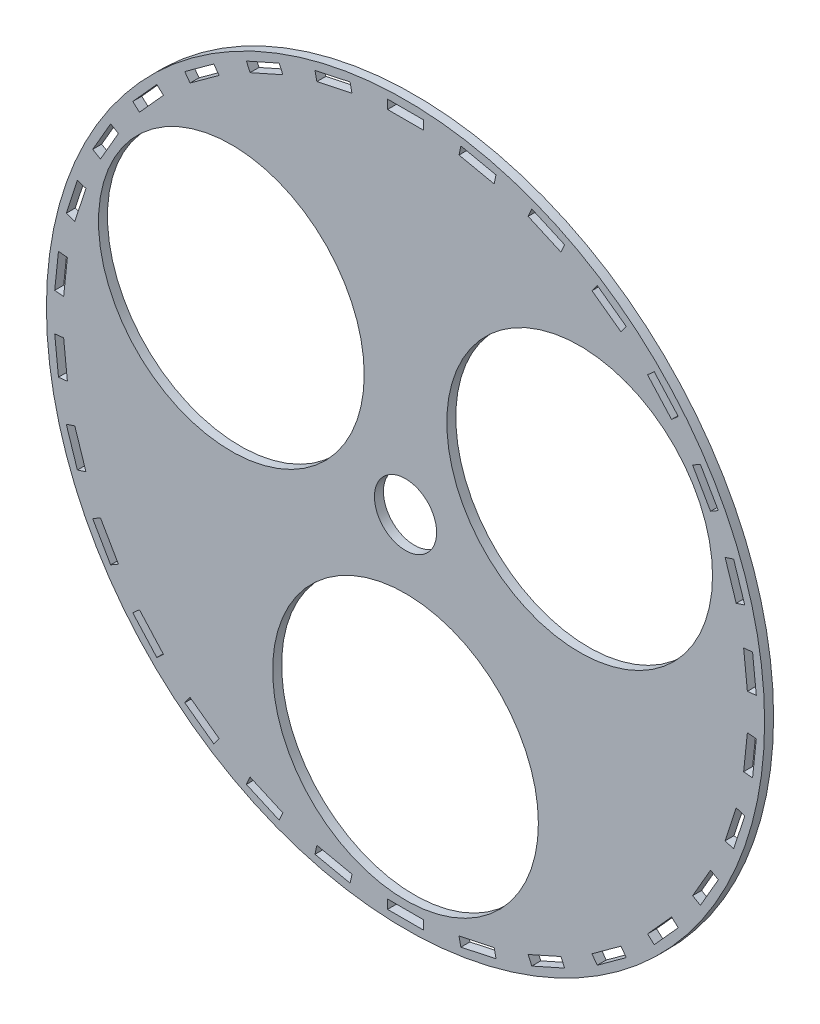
SolidWorks part; units mm, degrees
ref_plane "Front Plane" through (0, 0, 0) normal (0, 0, 1) x (1, 0, 0)
ref_plane "Top Plane" through (0, 0, 0) normal (0, 1, 0) x (1, 0, 0)
ref_plane "Right Plane" through (0, 0, 0) normal (1, 0, 0) x (0, 0, -1)
sketch "Sketch1" plane through (0, 0, 0) normal (0, 0, 1) x (1, 0, 0)
  line L0 (-31.3486, -116.9417) -> (-18.9261, -119.5822)
  line L1 (-6.35, -120.904) -> (6.35, -120.904)
  line L2 (-6.35, -120.904) -> (-6.35, -124.079)
  line L3 (-6.35, -124.079) -> (6.35, -124.079)
  line L4 (6.35, -120.904) -> (6.35, -124.079)
  line L5 (-31.3486, -116.9417) -> (-32.0087, -120.0473)
  line L6 (-32.0087, -120.0473) -> (-19.5862, -122.6878)
  line L7 (-18.9261, -119.5822) -> (-19.5862, -122.6878)
  line L8 (-54.9771, -107.8685) -> (-43.3751, -113.0341)
  line L9 (-54.9771, -107.8685) -> (-56.2685, -110.769)
  line L10 (-56.2685, -110.769) -> (-44.6665, -115.9346)
  line L11 (-43.3751, -113.0341) -> (-44.6665, -115.9346)
  line L12 (-76.2028, -94.081) -> (-65.9283, -101.5458)
  line L13 (-76.2028, -94.081) -> (-78.0691, -96.6496)
  line L14 (-78.0691, -96.6496) -> (-67.7945, -104.1145)
  line L15 (-65.9283, -101.5458) -> (-67.7945, -104.1145)
  line L16 (-94.0982, -76.1816) -> (-85.6002, -85.6195)
  line L17 (-94.0982, -76.1816) -> (-96.4576, -78.3061)
  line L18 (-96.4576, -78.3061) -> (-87.9597, -87.744)
  line L19 (-85.6002, -85.6195) -> (-87.9597, -87.744)
  line L20 (-107.8809, -54.9527) -> (-101.5309, -65.9513)
  line L21 (-107.8809, -54.9527) -> (-110.6306, -56.5402)
  line L22 (-110.6306, -56.5402) -> (-104.2806, -67.5388)
  line L23 (-101.5309, -65.9513) -> (-104.2806, -67.5388)
  line L24 (-116.9488, -31.3222) -> (-113.0243, -43.4006)
  line L25 (-116.9488, -31.3222) -> (-119.9684, -32.3033)
  line L26 (-119.9684, -32.3033) -> (-116.0439, -44.3817)
  line L27 (-113.0243, -43.4006) -> (-116.0439, -44.3817)
  line L28 (-120.9054, -6.3227) -> (-119.5779, -18.9531)
  line L29 (-120.9054, -6.3227) -> (-124.063, -6.6546)
  line L30 (-124.063, -6.6546) -> (-122.7355, -19.285)
  line L31 (-119.5779, -18.9531) -> (-122.7355, -19.285)
  line L32 (-119.5779, 18.9531) -> (-120.9054, 6.3227)
  line L33 (-119.5779, 18.9531) -> (-122.7355, 19.285)
  line L34 (-122.7355, 19.285) -> (-124.063, 6.6546)
  line L35 (-120.9054, 6.3227) -> (-124.063, 6.6546)
  line L36 (-113.0243, 43.4006) -> (-116.9488, 31.3222)
  line L37 (-113.0243, 43.4006) -> (-116.0439, 44.3817)
  line L38 (-116.0439, 44.3817) -> (-119.9684, 32.3033)
  line L39 (-116.9488, 31.3222) -> (-119.9684, 32.3033)
  line L40 (-101.5309, 65.9513) -> (-107.8809, 54.9527)
  line L41 (-101.5309, 65.9513) -> (-104.2806, 67.5388)
  line L42 (-104.2806, 67.5388) -> (-110.6306, 56.5402)
  line L43 (-107.8809, 54.9527) -> (-110.6306, 56.5402)
  line L44 (-85.6002, 85.6195) -> (-94.0982, 76.1816)
  line L45 (-85.6002, 85.6195) -> (-87.9597, 87.744)
  line L46 (-87.9597, 87.744) -> (-96.4576, 78.3061)
  line L47 (-94.0982, 76.1816) -> (-96.4576, 78.3061)
  line L48 (-65.9283, 101.5458) -> (-76.2028, 94.081)
  line L49 (-65.9283, 101.5458) -> (-67.7945, 104.1145)
  line L50 (-67.7945, 104.1145) -> (-78.0691, 96.6496)
  line L51 (-76.2028, 94.081) -> (-78.0691, 96.6496)
  line L52 (-43.3751, 113.0341) -> (-54.9771, 107.8685)
  line L53 (-43.3751, 113.0341) -> (-44.6665, 115.9346)
  line L54 (-44.6665, 115.9346) -> (-56.2685, 110.769)
  line L55 (-54.9771, 107.8685) -> (-56.2685, 110.769)
  line L56 (-18.9261, 119.5822) -> (-31.3486, 116.9417)
  line L57 (-18.9261, 119.5822) -> (-19.5862, 122.6878)
  line L58 (-19.5862, 122.6878) -> (-32.0087, 120.0473)
  line L59 (-31.3486, 116.9417) -> (-32.0087, 120.0473)
  line L60 (6.35, 120.904) -> (-6.35, 120.904)
  line L61 (6.35, 120.904) -> (6.35, 124.079)
  line L62 (6.35, 124.079) -> (-6.35, 124.079)
  line L63 (-6.35, 120.904) -> (-6.35, 124.079)
  line L64 (31.3486, 116.9417) -> (18.9261, 119.5822)
  line L65 (31.3486, 116.9417) -> (32.0087, 120.0473)
  line L66 (32.0087, 120.0473) -> (19.5862, 122.6878)
  line L67 (18.9261, 119.5822) -> (19.5862, 122.6878)
  line L68 (54.9771, 107.8685) -> (43.3751, 113.0341)
  line L69 (54.9771, 107.8685) -> (56.2685, 110.769)
  line L70 (56.2685, 110.769) -> (44.6665, 115.9346)
  line L71 (43.3751, 113.0341) -> (44.6665, 115.9346)
  line L72 (76.2028, 94.081) -> (65.9283, 101.5458)
  line L73 (76.2028, 94.081) -> (78.0691, 96.6496)
  line L74 (78.0691, 96.6496) -> (67.7945, 104.1145)
  line L75 (65.9283, 101.5458) -> (67.7945, 104.1145)
  line L76 (94.0982, 76.1816) -> (85.6002, 85.6195)
  line L77 (94.0982, 76.1816) -> (96.4576, 78.3061)
  line L78 (96.4576, 78.3061) -> (87.9597, 87.744)
  line L79 (85.6002, 85.6195) -> (87.9597, 87.744)
  line L80 (107.8809, 54.9527) -> (101.5309, 65.9513)
  line L81 (107.8809, 54.9527) -> (110.6306, 56.5402)
  line L82 (110.6306, 56.5402) -> (104.2806, 67.5388)
  line L83 (101.5309, 65.9513) -> (104.2806, 67.5388)
  line L84 (116.9488, 31.3222) -> (113.0243, 43.4006)
  line L85 (116.9488, 31.3222) -> (119.9684, 32.3033)
  line L86 (119.9684, 32.3033) -> (116.0439, 44.3817)
  line L87 (113.0243, 43.4006) -> (116.0439, 44.3817)
  line L88 (120.9054, 6.3227) -> (119.5779, 18.9531)
  line L89 (120.9054, 6.3227) -> (124.063, 6.6546)
  line L90 (124.063, 6.6546) -> (122.7355, 19.285)
  line L91 (119.5779, 18.9531) -> (122.7355, 19.285)
  line L92 (119.5779, -18.9531) -> (120.9054, -6.3227)
  line L93 (119.5779, -18.9531) -> (122.7355, -19.285)
  line L94 (122.7355, -19.285) -> (124.063, -6.6546)
  line L95 (120.9054, -6.3227) -> (124.063, -6.6546)
  line L96 (113.0243, -43.4006) -> (116.9488, -31.3222)
  line L97 (113.0243, -43.4006) -> (116.0439, -44.3817)
  line L98 (116.0439, -44.3817) -> (119.9684, -32.3033)
  line L99 (116.9488, -31.3222) -> (119.9684, -32.3033)
  line L100 (101.5309, -65.9513) -> (107.8809, -54.9527)
  line L101 (101.5309, -65.9513) -> (104.2806, -67.5388)
  line L102 (104.2806, -67.5388) -> (110.6306, -56.5402)
  line L103 (107.8809, -54.9527) -> (110.6306, -56.5402)
  line L104 (85.6002, -85.6195) -> (94.0982, -76.1816)
  line L105 (85.6002, -85.6195) -> (87.9597, -87.744)
  line L106 (87.9597, -87.744) -> (96.4576, -78.3061)
  line L107 (94.0982, -76.1816) -> (96.4576, -78.3061)
  line L108 (65.9283, -101.5458) -> (76.2028, -94.081)
  line L109 (65.9283, -101.5458) -> (67.7945, -104.1145)
  line L110 (67.7945, -104.1145) -> (78.0691, -96.6496)
  line L111 (76.2028, -94.081) -> (78.0691, -96.6496)
  line L112 (43.3751, -113.0341) -> (54.9771, -107.8685)
  line L113 (43.3751, -113.0341) -> (44.6665, -115.9346)
  line L114 (44.6665, -115.9346) -> (56.2685, -110.769)
  line L115 (54.9771, -107.8685) -> (56.2685, -110.769)
  line L116 (18.9261, -119.5822) -> (31.3486, -116.9417)
  line L117 (18.9261, -119.5822) -> (19.5862, -122.6878)
  line L118 (19.5862, -122.6878) -> (32.0087, -120.0473)
  line L119 (31.3486, -116.9417) -> (32.0087, -120.0473)
  circle A0 centre (0, 0) radius 127
  circle A1 centre (0, -71.12) radius 46.99
  circle A2 centre (-61.5917, 35.56) radius 46.99
  circle A3 centre (61.5917, 35.56) radius 46.99
  circle A4 centre (0, 0) radius 11
  point P7 (0, -120.904)
  point P128 (0, 0)
  point P134 (0, 0)
  dimension "D1" = 254
  dimension "D7" = 93.98
  dimension "D9" = 22
  dimension "D2" = 120.904
  dimension "D3" = 3.175
  dimension "D4" = 12.7
  dimension "D5" = 30
  dimension "D6" = 71.12
  dimension "D8" = 3
extrude "Boss-Extrude1" add sketch "Sketch1" along normal blind 3.175
